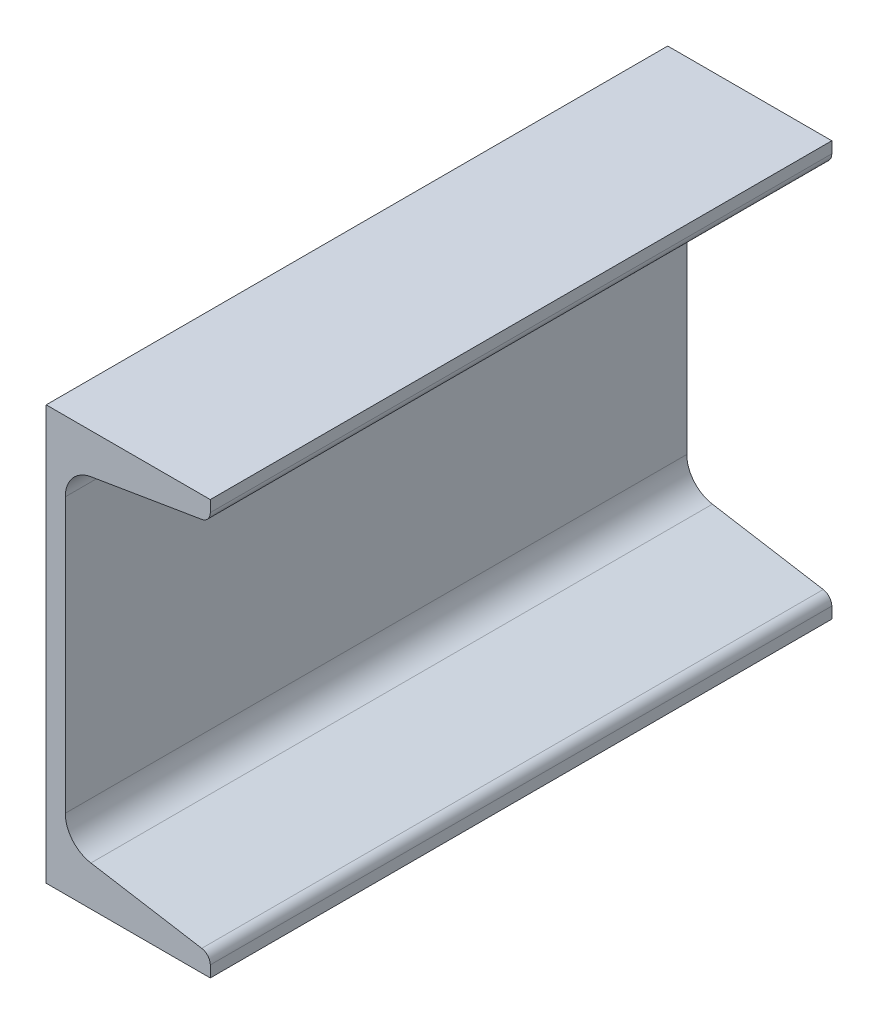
SolidWorks part; units mm, degrees
ref_plane "Front" through (0, 0, 0) normal (0, 0, 1) x (1, 0, 0)
ref_plane "Top" through (0, 0, 0) normal (0, 1, 0) x (1, 0, 0)
ref_plane "Side" through (0, 0, 0) normal (1, 0, 0) x (0, 0, -1)
sketch "Profile" plane through (0, 0, 0) normal (0, 0, 1) x (1, 0, 0)
  line L0 (0, -50.8) -> (40.2336, -50.8)
  line L1 (0, -50.8) -> (0, 50.8)
  line L2 (40.2336, 50.8) -> (0, 50.8)
  line L3 (0, 0) -> (4.6736, 0) construction
  line L4 (38.1395, -45.5469) -> (10.956, -41.0163)
  line L5 (40.2336, -48.0189) -> (40.2336, -50.8)
  line L6 (38.1395, 45.5469) -> (10.956, 41.0163)
  line L7 (40.2336, 50.8) -> (40.2336, 48.0189)
  line L8 (4.6736, 33.6002) -> (4.6736, -33.6002)
  line L9 (24.5477, -43.2816) -> (24.5477, -50.8) construction
  arc A0 (10.956, 41.0163) -> (4.6736, 33.6002) centre (12.192, 33.6002) ccw
  arc A1 (10.956, -41.0163) -> (4.6736, -33.6002) centre (12.192, -33.6002) cw
  arc A2 (40.2336, 48.0189) -> (38.1395, 45.5469) centre (37.7275, 48.0189) cw
  arc A3 (40.2336, -48.0189) -> (38.1395, -45.5469) centre (37.7275, -48.0189) ccw
  point P13 (4.6736, 39.9693)
  point P20 (40.2336, -45.8959)
  dimension "WebRadius" = 7.5184
  dimension "D1" = 2.5061
  dimension "Height" = 101.6
  dimension "Width" = 40.2336
  dimension "Angle" = 9.462
  dimension "ToeThick" = 7.5184
  dimension "WebThick" = 4.6736
extrude "Channel" add sketch "Profile" along normal mid plane 152.4
ref_plane "AnchorMate1" through (22.8961, 22.8961, 0) normal (-0.7071, -0.7071, 0) x (0.7071, -0.7071, 0)
ref_plane "AnchorMate2" through (22.8961, -22.8961, 0) normal (-0.7071, 0.7071, 0) x (-0.7071, -0.7071, 0)
equation "\"D1@Profile\" = \"ToeThick@Profile\"/3"
